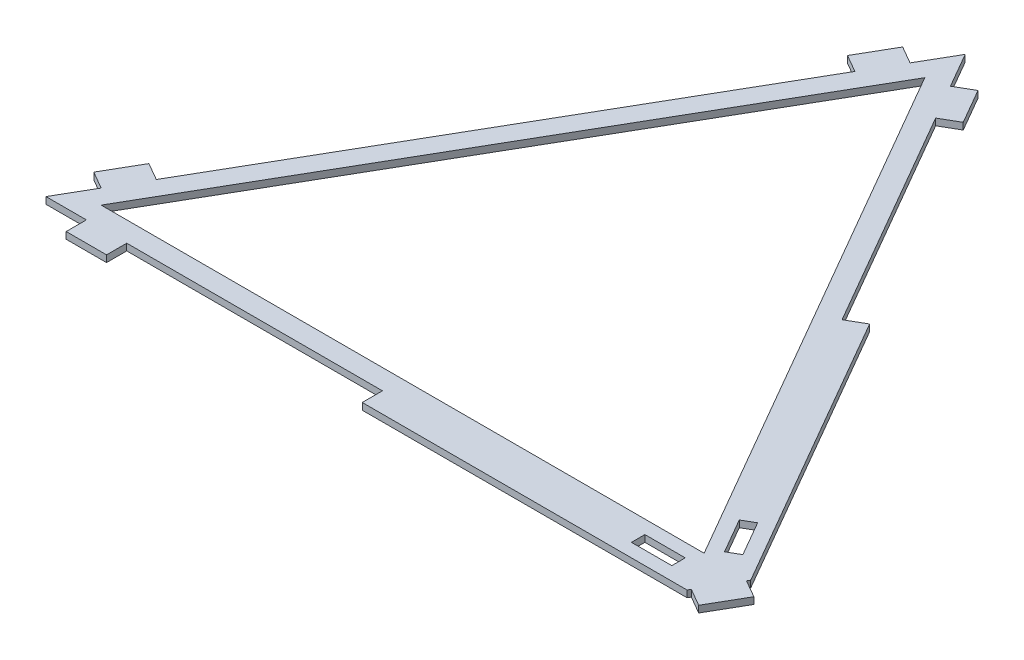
SolidWorks part; units mm, degrees
ref_plane "Alzado" through (0, 0, 0) normal (0, 0, 1) x (1, 0, 0)
ref_plane "Planta" through (0, 0, 0) normal (0, 1, 0) x (1, 0, 0)
ref_plane "Vista lateral" through (0, 0, 0) normal (1, 0, 0) x (0, 0, -1)
sketch "Croquis1" plane through (0, 0, 0) normal (0, 1, 0) x (1, 0, 0)
  line L0 (0, 0) -> (500, 0) construction
  line L1 (500, 0) -> (250, 433.0127) construction
  line L2 (250, 433.0127) -> (0, 0) construction
  line L3 (25.9808, 15) -> (474.0192, 15)
  line L4 (474.0192, 15) -> (250, 403.0127)
  line L5 (250, 403.0127) -> (25.9808, 15)
  line L6 (30, 51.9615) -> (220, 381.0512)
  line L7 (250, 433.0127) -> (235, 407.0319)
  line L8 (235, 407.0319) -> (222.0096, 414.5319)
  line L9 (508.6603, 15) -> (507.5, 12.9904)
  line L10 (507.5, 12.9904) -> (520.4904, 5.4904)
  line L11 (222.0096, 414.5319) -> (207.0096, 388.5512)
  line L12 (207.0096, 388.5512) -> (220, 381.0512)
  line L13 (508.6603, 15) -> (387.9904, 224.0064)
  line L14 (250, 433.0127) -> (250, 403.0127) construction
  line L15 (508.6603, 15) -> (521.6506, 7.5) construction
  line L16 (292.9904, 388.5512) -> (280, 381.0512)
  line L17 (277.9904, 414.5319) -> (292.9904, 388.5512)
  line L18 (265, 407.0319) -> (277.9904, 414.5319)
  line L19 (250, 433.0127) -> (265, 407.0319)
  line L20 (521.6506, 7.5) -> (504.3301, -22.5) construction
  line L21 (504.3301, -22.5) -> (491.3397, -15) construction
  line L22 (474.0192, 15) -> (500, 0) construction
  line L23 (474.3301, 54.4615) -> (480.6699, 23.4808) construction
  line L24 (440, 5) -> (470, 5)
  line L25 (440, 5) -> (440, -5)
  line L26 (440, -5) -> (470, -5)
  line L27 (470, 5) -> (470, -5)
  line L28 (440, 5) -> (470, -5) construction
  line L29 (440, -5) -> (470, 5) construction
  line L30 (465.6699, 49.4615) -> (489.3301, 28.4808) construction
  line L31 (480.6699, 23.4808) -> (489.3301, 28.4808)
  line L32 (474.3301, 54.4615) -> (489.3301, 28.4808)
  line L33 (465.6699, 49.4615) -> (474.3301, 54.4615)
  line L34 (465.6699, 49.4615) -> (480.6699, 23.4808)
  line L35 (512.9904, 7.5) -> (262.9904, 440.5127) construction
  line L36 (508.6603, 15) -> (491.3397, -15) construction
  line L37 (375, 216.5064) -> (280, 381.0512)
  line L38 (250, 433.0127) -> (235, 407.0319)
  line L39 (235, 407.0319) -> (222.0096, 414.5319)
  line L40 (222.0096, 414.5319) -> (207.0096, 388.5512)
  line L41 (207.0096, 388.5512) -> (220, 381.0512)
  line L42 (292.9904, 388.5512) -> (280, 381.0512)
  line L43 (277.9904, 414.5319) -> (292.9904, 388.5512)
  line L44 (265, 407.0319) -> (277.9904, 414.5319)
  line L45 (250, 433.0127) -> (265, 407.0319)
  line L46 (491.3397, -15) -> (250, -15)
  line L47 (0, 0) -> (25.9808, 15) construction
  line L48 (250, 0) -> (250, -15)
  line L49 (0, 0) -> (30, 0)
  line L50 (30, 0) -> (30, -15)
  line L51 (30, -15) -> (60, -15)
  line L52 (60, -15) -> (60, 0)
  line L53 (17.0096, 59.4615) -> (30, 51.9615)
  line L54 (2.0096, 33.4808) -> (17.0096, 59.4615)
  line L55 (15, 25.9808) -> (2.0096, 33.4808)
  line L56 (375, 216.5064) -> (387.9904, 224.0064)
  line L57 (0, 0) -> (15, 25.9808)
  line L58 (250, 0) -> (60, 0)
  line L59 (0, 0) -> (30, 0)
  line L60 (30, 0) -> (30, -15)
  line L61 (30, -15) -> (60, -15)
  line L62 (60, -15) -> (60, 0)
  line L63 (17.0096, 59.4615) -> (30, 51.9615)
  line L64 (2.0096, 33.4808) -> (17.0096, 59.4615)
  line L65 (15, 25.9808) -> (2.0096, 33.4808)
  line L66 (0, 0) -> (15, 25.9808)
  line L67 (520.4904, 5.4904) -> (505.4904, -20.4904)
  line L68 (505.4904, -20.4904) -> (492.5, -12.9904)
  line L69 (492.5, -12.9904) -> (491.3397, -15)
  point P20 (455, 0)
  point P31 (477.5, 38.9711)
  dimension "D4" = 30
  dimension "D5" = 15
  dimension "D6" = 30
  dimension "D7" = 500
  dimension "D8" = 34.641
  dimension "D9" = 15
  dimension "D10" = 30
  dimension "D11" = 10
  dimension "D12" = 30
  dimension "D2" = 15
  dimension "D3" = 30
  dimension "D13" = 30
extrude "Saliente-Extruir1" add sketch "Croquis1" along normal blind 5
